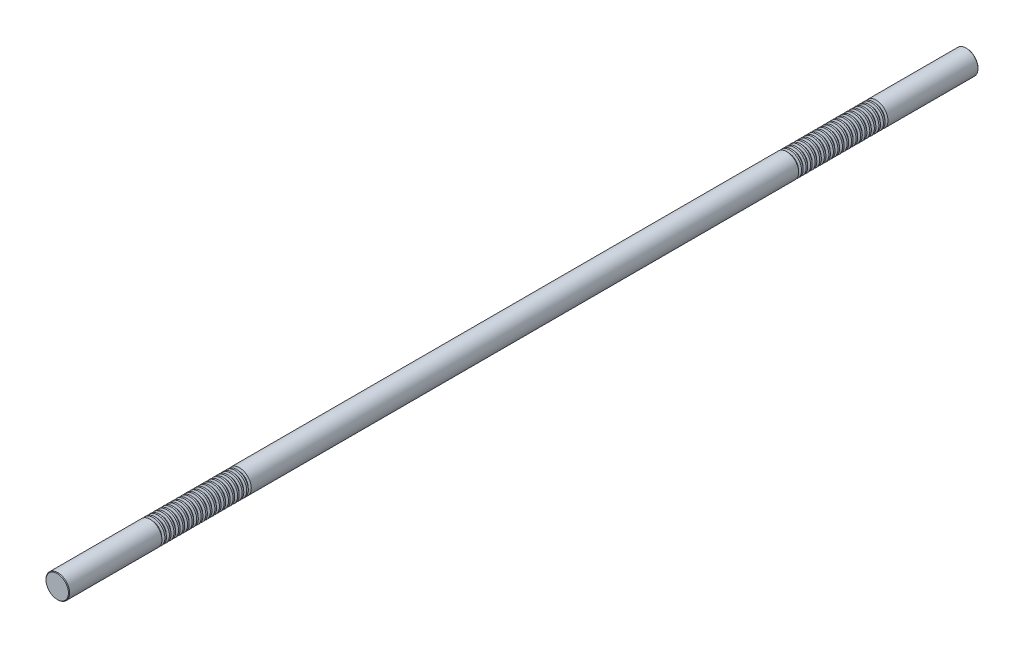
SolidWorks part; units mm, degrees
ref_plane "Front Plane" through (0, 0, 0) normal (0, 0, 1) x (1, 0, 0)
ref_plane "Top Plane" through (0, 0, 0) normal (0, 1, 0) x (1, 0, 0)
ref_plane "Right Plane" through (0, 0, 0) normal (1, 0, 0) x (0, 0, -1)
sketch "Sketch1" plane through (0, 0, 0) normal (0, 0, 1) x (1, 0, 0)
  circle A0 centre (0, 0) radius 13
  dimension "D1" = 26
extrude "Boss-Extrude1" add sketch "Sketch1" along normal mid plane 1000
chamfer "Chamfer1" distance 0.65 angle 45 2 edges at (13, 0, -500) (13, 0, 500)
sketch "Sketch2" plane through (0, 0, 0) normal (1, 0, 0) x (0, 0, -1)
  line L0 (400.3684, 13) -> (397.1316, 13)
  line L1 (499.35, 13) -> (-499.35, 13) construction
  line L2 (397.1316, 13) -> (397.8684, 10.25)
  line L3 (397.8684, 10.25) -> (399.6316, 10.25)
  line L4 (399.6316, 10.25) -> (400.3684, 13)
  line L5 (500, -12.35) -> (500, 12.35) construction
  point P4 (398.75, 13)
  point P7 (398.75, 10.25)
  point P8 (400, 11.625)
  point P9 (397.5, 11.625)
  dimension "D1" = 2.5
  dimension "D2" = 100
  dimension "D3" = 2.75
  dimension "D4" = 30
revolve "Cut-Revolve1" cut sketch "Sketch2" angle 360 about axis through (0, 0, 500) along (0, 0, -1)
pattern_linear "LPattern1" count 20 spacing 5 along (0, 0, 1) of "Cut-Revolve1"
pattern_linear "LPattern2" count 2 spacing 700 along (0, 0, 1) of "Cut-Revolve1", "LPattern1"
